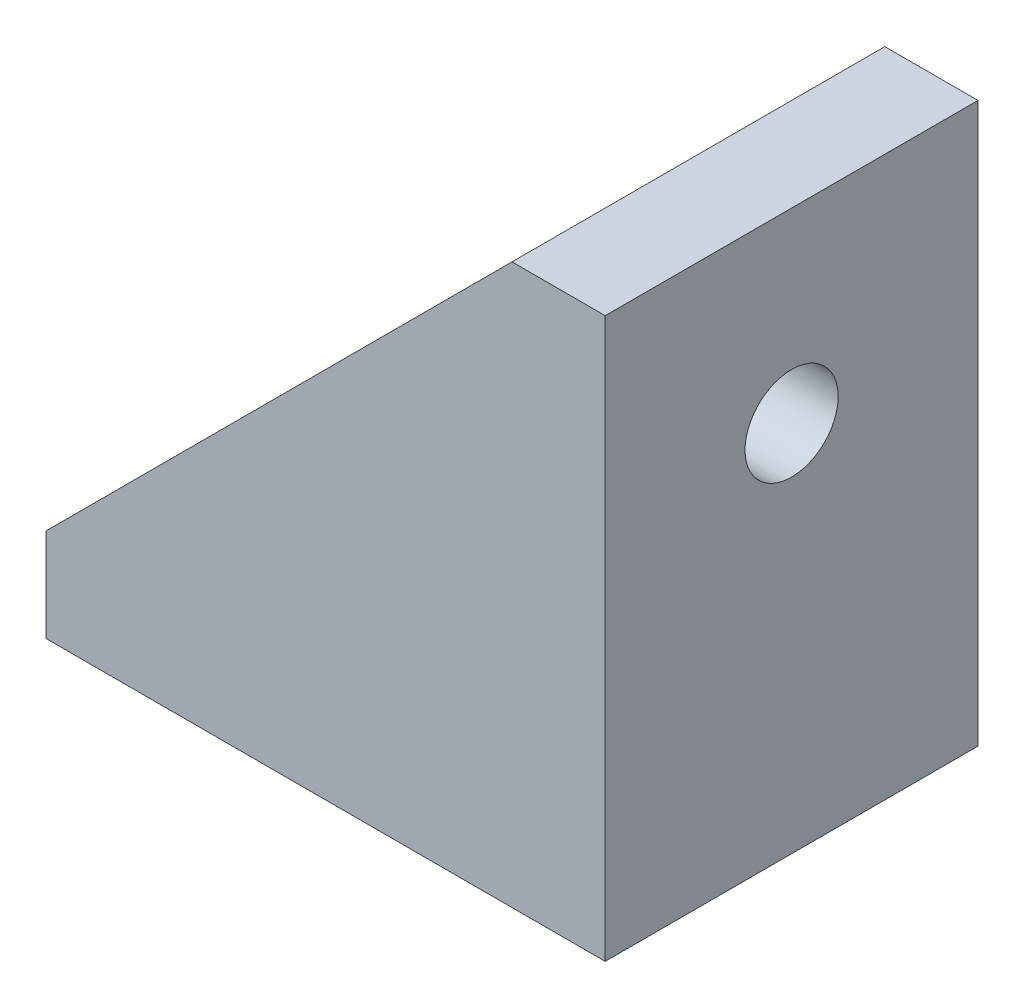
SolidWorks part; units mm, degrees
ref_plane "正面" through (0, 0, 0) normal (0, 0, 1) x (1, 0, 0)
ref_plane "平面" through (0, 0, 0) normal (0, 1, 0) x (1, 0, 0)
ref_plane "右側面" through (0, 0, 0) normal (1, 0, 0) x (0, 0, -1)
sketch "ｽｹｯﾁ1" plane through (0, 0, 0) normal (0, 0, 1) x (1, 0, 0)
  line L0 (-5, 30) -> (-30, 5)
  line L1 (0, 0) -> (-30, 0)
  line L2 (0, 0) -> (0, 5)
  line L3 (0, 5) -> (-30, 5)
  line L4 (-30, 0) -> (-30, 5)
  line L5 (0, 0) -> (-5, 0)
  line L6 (0, 0) -> (0, 30)
  line L7 (0, 30) -> (-5, 30)
  line L8 (-5, 0) -> (-5, 30)
  line L9 (-30, 5) -> (-5, 5)
  line L10 (-5, 5) -> (-5, 30)
  dimension "D1" = 30
  dimension "D2" = 30
  dimension "D3" = 5
  dimension "D4" = 5
  dimension "D5" = 0
  dimension "D6" = 0
  dimension "D7" = 25
  dimension "D8" = 25
extrude "ﾎﾞｽ - 押し出し1" add sketch "ｽｹｯﾁ1" along normal blind 20 contours L10 L0 L9 | L6 L5 L8 L7 | L2 L1 L4 L3
sketch "ｽｹｯﾁ2" plane through (-30, 0, 0) normal (-1, 0, 0) x (0, 0, 1)
  line L0 (20, 30) -> (0, 30) construction
  line L1 (2, 5) -> (18, 5)
  line L2 (2, 5) -> (2, 30)
  line L3 (2, 30) -> (18, 30)
  line L4 (18, 5) -> (18, 30)
  line L5 (0, 30) -> (0, 5) construction
  line L6 (20, 30) -> (20, 5) construction
  line L7 (20, 0) -> (0, 0) construction
  dimension "D1" = 2
  dimension "D2" = 2
  dimension "D3" = 5
extrude "ｶｯﾄ - 押し出し1" cut sketch "ｽｹｯﾁ2" against normal blind 25 contours L2 L1 L4 L3
sketch "ｽｹｯﾁ3" plane through (-5, 0, 0) normal (-1, 0, 0) x (0, 0, 1)
  line L0 (0, 30) -> (0, 5) construction
  line L1 (2, 30) -> (18, 30) construction
  circle A0 centre (10, 20) radius 2.5
  dimension "D1" = 10
  dimension "D2" = 5
  dimension "D3" = 10
extrude "ｶｯﾄ - 押し出し2" cut sketch "ｽｹｯﾁ3" against normal through all contours A0
sketch "ｽｹｯﾁ4" plane through (0, 5, 0) normal (0, 1, 0) x (1, 0, 0)
  line L0 (-5, -20) -> (-30, -20) construction
  line L1 (-30, -2) -> (-30, -18) construction
  circle A0 centre (-20, -10) radius 2.5
  dimension "D1" = 10
  dimension "D2" = 10
  dimension "D3" = 5
extrude "ｶｯﾄ - 押し出し3" cut sketch "ｽｹｯﾁ4" against normal through all contours A0
